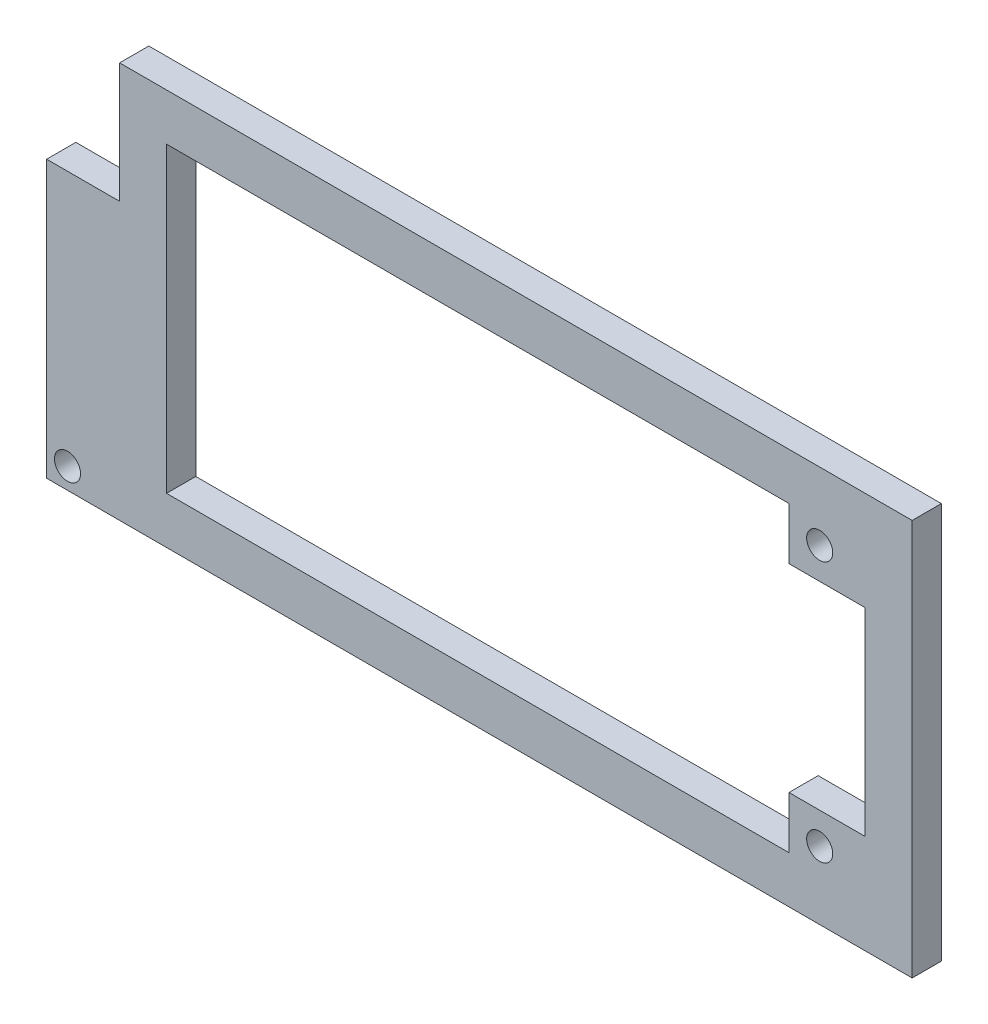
SolidWorks part; units mm, degrees
ref_plane "Front Plane" through (0, 0, 0) normal (0, 0, 1) x (1, 0, 0)
ref_plane "Top Plane" through (0, 0, 0) normal (0, 1, 0) x (1, 0, 0)
ref_plane "Right Plane" through (0, 0, 0) normal (1, 0, 0) x (0, 0, -1)
sketch "Sketch1" plane through (0, 0, 0) normal (0, 0, 1) x (1, 0, 0)
  line L0 (0, 0) -> (0, 26.5)
  line L1 (0, 26.5) -> (7, 26.5)
  line L2 (7, 26.5) -> (7, 38)
  line L3 (7, 38) -> (83, 38)
  line L4 (83, 38) -> (83, 0)
  line L5 (83, 0) -> (0, 0)
  line L6 (11.5, 33.5) -> (11.5, 4.5)
  line L7 (11.5, 4.5) -> (71.187, 4.5)
  line L8 (71.187, 4.5) -> (71.187, 9.5)
  line L9 (71.187, 9.5) -> (78.5, 9.5)
  line L10 (78.5, 9.5) -> (78.5, 28.5)
  line L11 (78.5, 28.5) -> (71.187, 28.5)
  line L12 (71.187, 28.5) -> (71.187, 33.5)
  line L13 (71.187, 33.5) -> (11.5, 33.5)
  circle A0 centre (74.1308, 6.5) radius 1.25
  circle A1 centre (74.1308, 31.5) radius 1.25
  circle A2 centre (2, 2) radius 1.25
  dimension "D7" = 2.5
  dimension "D8" = 2.5
  dimension "D9" = 2.5
  dimension "D1" = 26.5
  dimension "D2" = 38
  dimension "D3" = 83
  dimension "D4" = 76
  dimension "D5" = 4.5
  dimension "D6" = 4.5
  dimension "D10" = 2
  dimension "D11" = 2
  dimension "D12" = 6.5
  dimension "D13" = 6.5
  dimension "D14" = 25
  dimension "D15" = 4.5
  dimension "D16" = 4.5
  dimension "D17" = 3
  dimension "D18" = 3
extrude "Extrude1" add sketch "Sketch1" along normal blind 2.8
ref_plane "Plane1" through (0, 19, 0) normal (0, 1, 0) x (-1, 0, 0)
ref_plane "Plane2" through (41.5, 0, 0) normal (-1, 0, 0) x (0, 0, 1)
